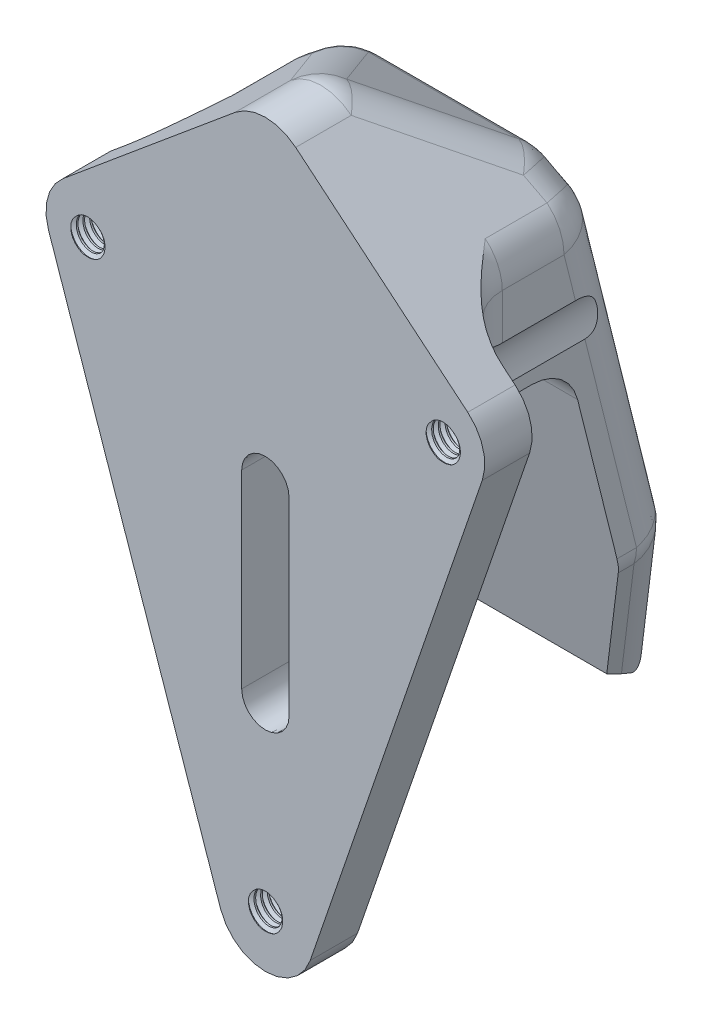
SolidWorks part; units mm, degrees
ref_plane "Front Plane" through (0, 0, 0) normal (0, 0, 1) x (1, 0, 0)
ref_plane "Top Plane" through (0, 0, 0) normal (0, 1, 0) x (1, 0, 0)
ref_plane "Right Plane" through (0, 0, 0) normal (1, 0, 0) x (0, 0, -1)
sketch "Sketch1" plane through (0, 0, 0) normal (0, 0, 1) x (1, 0, 0)
  line L0 (0, 0) -> (0, 20) construction
  line L1 (0, 20) -> (-24, 0)
  line L2 (-24, 0) -> (0, -70)
  line L3 (24, 0) -> (0, -70)
  line L4 (0, 20) -> (24, 0)
  line L5 (-24, 0) -> (24, 0) construction
  dimension "D1" = 48
  dimension "D2" = 70
  dimension "D3" = 20
extrude "Boss-Extrude1" add sketch "Sketch1" along normal blind 5
sketch "Sketch2" plane through (0, 0, 0) normal (1, 0, 0) x (0, 0, -1)
  line L0 (0, -5) -> (12, -5)
  line L1 (12, -5) -> (22, -45)
  line L2 (22, -45) -> (28.791, -43.3023)
  line L3 (28.791, -43.3023) -> (15.4654, 10)
  line L5 (0, -70) -> (0, 0) construction
  line L6 (0, 20) -> (0, -5)
  line L7 (0, 20) -> (15.4654, 10)
  dimension "D1" = 40
  dimension "D2" = 22
  dimension "D3" = 12
  dimension "D4" = 7
  dimension "D5" = 5
  dimension "D6" = 15
extrude "Boss-Extrude2" add sketch "Sketch2" along normal mid plane 60
sketch "Sketch3" plane through (0, 0, 0) normal (0, 0, 1) x (1, 0, 0)
  line L0 (0, 20) -> (-15, 7.5)
  line L1 (-15, -26.25) -> (0, -70)
  line L2 (0, -70) -> (15, -26.25)
  line L3 (15, 7.5) -> (0, 20)
  line L4 (0, 0) -> (0, -70) construction
  line L5 (-15, 7.5) -> (-15, -26.25)
  line L6 (15, 7.5) -> (15, -26.25)
  line L7 (-24, 0) -> (0, -70) construction
  line L8 (24, 0) -> (0, 20) construction
  dimension "D1" = 30
extrude "Cut-Extrude1" cut sketch "Sketch3" against normal through all flip side to cut
fillet "Fillet1" radius 5 10 edges at (0, -5, -12) (0, -5, 0) (15, -26.25, -20.9202) (-15, -26.25, -20.9202) (-15, 7.5, -8.0452) (15, 7.5, -8.0452) (0, -70, 2.5) (0, 20, 2.5) (24, 0, 2.5) (-24, 0, 2.5)
fillet "Fillet2" radius 5 16 edges at (-14.5279, 7.2789, 0) (14.5279, 7.2789, 0) (14.932, -26.2387, -24.5251) (15, -10.1293, -20.4978) (14.5279, 7.2789, -16.1457) (12.6005, 9.4996, -15.5905) (-12.6005, 9.4996, -15.5905) (-14.5279, 7.2789, -16.1457) (-15, -10.1293, -20.4978) (-14.932, -26.2387, -24.5251) (-11.9416, -35.1703, -26.758) (11.9416, -35.1703, -26.758) (-15, -2.4209, 0) (15, -2.4209, 0) (0, 10, -15.4654) (0, -43.3023, -28.791)
hole_wizard "Tap Drill for M4x0.7 Tap1" positions "Sketch4" profile "Sketch5" hole size "M4x0.7" standard "ANSI Metric"
sketch "Sketch4" plane through (0, 0, 0) normal (0, 0, -1) x (-1, 0, 0)
  line L0 (0, 0) -> (0, -59.5833) construction
  line L2 (-18.1533, -1.6363) -> (18.1533, -1.6363) construction
  arc A0 (-4.7297, -56.205) -> (4.7297, -56.205) centre (0, -54.5833) ccw construction
  point P8 (0, -53.8731)
  point P19 (-18.75, -1.6363)
  point P29 (18.75, -1.6363)
sketch "Sketch5" plane through (-18.75, -1.6363, 0) normal (1, 0, 0) x (0, 1, 0)
  line L0 (0, 0) -> (0, 5)
  line L1 (0, 5) -> (1.65, 5)
  line L2 (1.65, 5) -> (1.65, 0)
  line L5 (1.65, 0) -> (0, 0)
  line L11 (0, -6.35) -> (0, 107.95) construction
  dimension "Thru Hole Dia." = 3.3
  dimension "Thru Hole Depth" = 5
sketch "Sketch6" plane through (0, 0, 0) normal (0, 0, -1) x (-1, 0, 0)
  circle A0 centre (-18.75, -1.6363) radius 4.25
  circle A1 centre (-18.75, -1.6363) radius 1.65 construction
  circle A2 centre (18.75, -1.6363) radius 4.25
  circle A3 centre (0, -53.8731) radius 4.25
  dimension "D1" = 8.5
extrude "Cut-Extrude2" cut sketch "Sketch6" along normal through all
thread "Thread1" pitch 0.7 start angle 0, offset 0, length 10, pitch 0.7, diameter 3.3
ref_plane "Plane1" through (20.4, -1.6363, 0) normal (0, -1, 0) x (1, 0, 0)
sketch "Thread Profile1" plane through (20.4, -1.6363, 0) normal (0, -1, 0) x (1, 0, 0)
  line L0 (0, 0) -> (0, 0.7) construction
  line L1 (0, 0) -> (0.3789, 0.2187)
  line L2 (0.3789, 0.2187) -> (0.3789, 0.3062)
  line L3 (0.3789, 0.3062) -> (0, 0.525)
  line L4 (0.3789, 0.2625) -> (0, 0.2625) construction
  line L11 (0, 0) -> (0, 0.525)
  point P2 (0, 0)
  dimension "Pitch" = 0.7
  dimension "Profile_Angle" = 60
  dimension "Profile_Land" = 0.0875
  dimension "Profile_Height" = 0.3789
thread "Thread2" pitch 0.7 start angle 0, offset 0, length 10, pitch 0.7, diameter 3.3
ref_plane "Plane2" through (-17.1, -1.6363, 0) normal (0, -1, 0) x (1, 0, 0)
sketch "Thread Profile2" plane through (-17.1, -1.6363, 0) normal (0, -1, 0) x (1, 0, 0)
  line L0 (0, 0) -> (0, 0.7) construction
  line L1 (0, 0) -> (0.3789, 0.2187)
  line L2 (0.3789, 0.2187) -> (0.3789, 0.3062)
  line L3 (0.3789, 0.3062) -> (0, 0.525)
  line L4 (0.3789, 0.2625) -> (0, 0.2625) construction
  line L11 (0, 0) -> (0, 0.525)
  point P2 (0, 0)
  dimension "Pitch" = 0.7
  dimension "Profile_Angle" = 60
  dimension "Profile_Land" = 0.0875
  dimension "Profile_Height" = 0.3789
thread "Thread3" pitch 0.7 start angle 0, offset 0, length 10, pitch 0.7, diameter 3.3
ref_plane "Plane3" through (1.65, -53.8731, 0) normal (0, -1, 0) x (1, 0, 0)
sketch "Thread Profile3" plane through (1.65, -53.8731, 0) normal (0, -1, 0) x (1, 0, 0)
  line L0 (0, 0) -> (0, 0.7) construction
  line L1 (0, 0) -> (0.3789, 0.2187)
  line L2 (0.3789, 0.2187) -> (0.3789, 0.3062)
  line L3 (0.3789, 0.3062) -> (0, 0.525)
  line L4 (0.3789, 0.2625) -> (0, 0.2625) construction
  line L11 (0, 0) -> (0, 0.525)
  point P2 (0, 0)
  dimension "Pitch" = 0.7
  dimension "Profile_Angle" = 60
  dimension "Profile_Land" = 0.0875
  dimension "Profile_Height" = 0.3789
sketch "Sketch13" plane through (0, 0, 5) normal (0, 0, 1) x (1, 0, 0)
  line L0 (0, -15) -> (0, -35) construction
  line L1 (2.5, -15) -> (2.5, -35)
  line L2 (-2.5, -15) -> (-2.5, -35)
  arc A0 (2.5, -15) -> (-2.5, -15) centre (0, -15) ccw
  arc A1 (-2.5, -35) -> (2.5, -35) centre (0, -35) ccw
  point P3 (0, -25)
  dimension "D1" = 5
  dimension "D2" = 15
  dimension "D3" = 20
extrude "Cut-Extrude3" cut sketch "Sketch13" against normal up to surface (5 mm away)
fillet "Fillet3" radius 5 5 edges at (8.6225, 9.7816, -15.1601) (5.6598, 15.2835, -7.2943) (0, 18.4915, -2.333) (-8.6225, 9.7816, -15.1601) (-5.6598, 15.2835, -7.2943)
chamfer "Chamfer1" distance 5 angle 45 1 edges at (0, -45, -22)
fillet "Fillet4" radius 2 1 edges at (0, -43.3443, -26.1124)
equation "\"D2@Sketch4\"=37.5"
